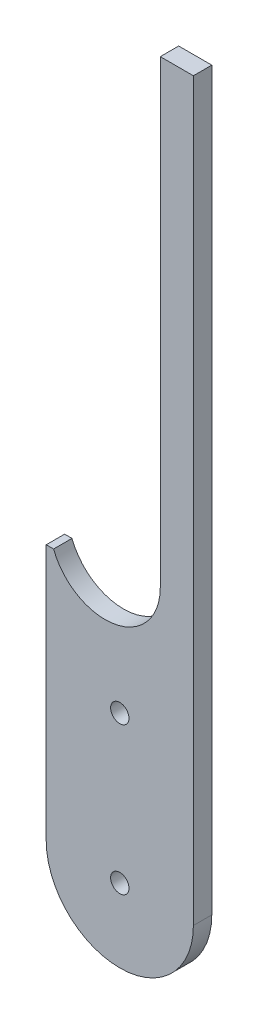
SolidWorks part; units mm, degrees
ref_plane "Front Plane" through (0, 0, 0) normal (0, 0, 1) x (1, 0, 0)
ref_plane "Top Plane" through (0, 0, 0) normal (0, 1, 0) x (1, 0, 0)
ref_plane "Right Plane" through (0, 0, 0) normal (1, 0, 0) x (0, 0, -1)
sketch "Sketch1" plane through (0, 0, 0) normal (0, 0, 1) x (1, 0, 0)
  line L0 (-24.13, 56.9054) -> (-25.4, 56.9054)
  line L1 (0, 0) -> (-25.4, 0)
  line L2 (0, 0) -> (0, 50.8)
  line L3 (0, 50.8) -> (-25.4, 50.8)
  line L4 (-25.4, 0) -> (-25.4, 50.8)
  line L5 (-25.4, 56.9054) -> (-25.4, 50.8)
  line L6 (-5.715, 60.325) -> (-5.715, 139.7)
  line L7 (-5.715, 139.7) -> (0, 139.7)
  line L8 (0, 139.7) -> (0, 50.8)
  arc A0 (-24.13, 56.9054) -> (-5.715, 60.325) centre (-15.24, 60.325) ccw
  point P10 (-3.699, 107.3467)
  dimension "D3" = 9.525
  dimension "D1" = 25.4
  dimension "D2" = 50.8
  dimension "D4" = 10.16
  dimension "D5" = 1.27
  dimension "D6" = 9.525
  dimension "D7" = 90
  dimension "D8" = 88.9
extrude "Boss-Extrude1" add sketch "Sketch1" along normal blind 3.175 contours L4 L1 L2 L3 | A0 L3 L8 L7 L6 | A0 L0 L5 L3
sketch "Sketch2" plane through (0, 0, 3.175) normal (0, 0, 1) x (1, 0, 0)
  line L0 (0, 0) -> (-25.4, 0) construction
  line L1 (-25.4, 0) -> (-25.4, 56.9054) construction
  circle A0 centre (-12.7, 38.1) radius 1.5875
  circle A1 centre (-12.7, 12.7) radius 1.5875
  point P8 (-23.0695, 38.1)
  dimension "D1" = 3.175
  dimension "D2" = 3.175
  dimension "D3" = 12.7
  dimension "D4" = 12.7
  dimension "D5" = 25.4
  dimension "D6" = 0
extrude "Cut-Extrude1" cut sketch "Sketch2" against normal blind 3.175
fillet "Fillet1" radius 12.7 2 edges at (0, 0, 1.5875) (-25.4, 0, 1.5875)
